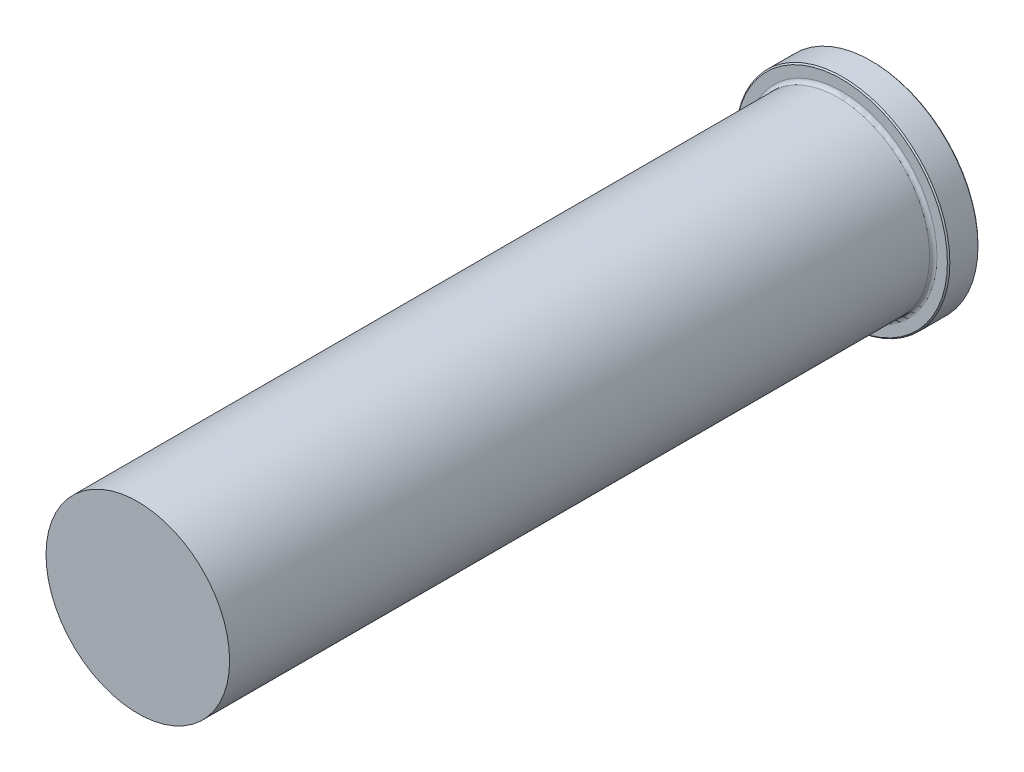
SolidWorks part; units mm, degrees
ref_plane "Front Plane" through (0, 0, 0) normal (0, 0, 1) x (1, 0, 0)
ref_plane "Top Plane" through (0, 0, 0) normal (0, 1, 0) x (1, 0, 0)
ref_plane "Right Plane" through (0, 0, 0) normal (1, 0, 0) x (0, 0, -1)
sketch "Sketch1" plane through (0, 0, 0) normal (1, 0, 0) x (0, 0, -1)
  line L0 (0, 0) -> (-156.8087, 0) construction
  line L1 (0, 0) -> (0, 22.225)
  line L2 (0, 22.225) -> (-6.35, 22.225)
  line L3 (-6.35, 22.225) -> (-6.35, 19.05)
  line L4 (-6.35, 19.05) -> (-152.4, 19.05)
  line L5 (-152.4, 19.05) -> (-152.4, 0)
  line L6 (-152.4, 0) -> (0, 0)
  dimension "D1" = 44.45
  dimension "D2" = 38.1
  dimension "D3" = 6.35
  dimension "D4" = 152.4
revolve "Revolve1" add sketch "Sketch1" angle 360 about L0
fillet "Fillet1" radius 0.762 1 edges at (-19.05, 0, 6.35)
chamfer "Chamfer1" distance 0.254 angle 45 2 edges at (-22.225, 0, 0) (-22.225, 0, 6.35)
